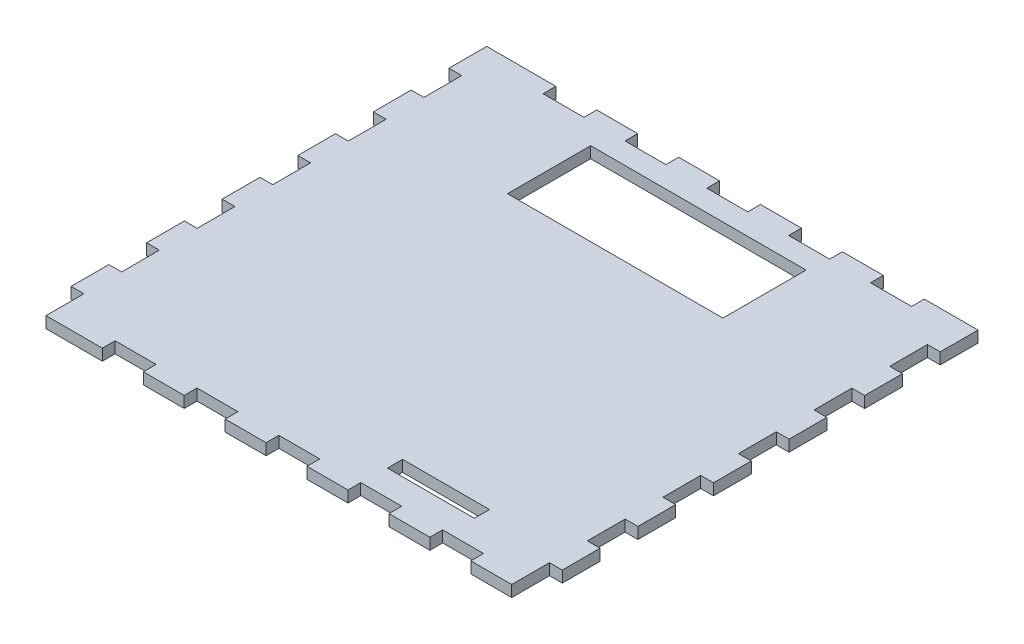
SolidWorks part; units mm, degrees
ref_plane "Front Plane" through (0, 0, 0) normal (0, 0, 1) x (1, 0, 0)
ref_plane "Top Plane" through (0, 0, 0) normal (0, 1, 0) x (1, 0, 0)
ref_plane "Right Plane" through (0, 0, 0) normal (1, 0, 0) x (0, 0, -1)
sketch "Sketch1" plane through (0, 0, 0) normal (0, 1, 0) x (1, 0, 0)
  line L0 (30, -49.7642) -> (30, -60) construction
  line L1 (-65, 60) -> (65, 60)
  line L2 (-65, 60) -> (-65, -60)
  line L3 (-65, -60) -> (65, -60)
  line L4 (65, 60) -> (65, -60)
  line L5 (-65, 60) -> (65, -60) construction
  line L6 (-65, -60) -> (65, 60) construction
  line L7 (65, -47.7642) -> (30, -47.7642) construction
  line L8 (18.5, -45.7642) -> (41.5, -45.7642)
  line L9 (18.5, -45.7642) -> (18.5, -49.7642)
  line L10 (18.5, -49.7642) -> (41.5, -49.7642)
  line L11 (41.5, -45.7642) -> (41.5, -49.7642)
  line L12 (18.5, -45.7642) -> (41.5, -49.7642) construction
  line L13 (18.5, -49.7642) -> (41.5, -45.7642) construction
  point P0 (0, 0)
  dimension "D1" = 120
  dimension "D2" = 130
  dimension "D3" = 23
  dimension "D4" = 35
  dimension "D5" = 4
  dimension "D6" = 10.2358
extrude "Boss-Extrude1" add sketch "Sketch1" along normal blind 3
sketch "Sketch3" plane through (0, 3, 0) normal (0, 1, 0) x (1, 0, 0)
  line L0 (0, 60) -> (0, 40) construction
  line L1 (65, 60) -> (-65, 60) construction
  line L3 (-28.5, 51) -> (28.5, 51)
  line L4 (-28.5, 51) -> (-28.5, 29)
  line L5 (-28.5, 29) -> (28.5, 29)
  line L6 (28.5, 51) -> (28.5, 29)
  line L7 (-28.5, 51) -> (28.5, 29) construction
  line L8 (-28.5, 29) -> (28.5, 51) construction
  dimension "D1" = 20
  dimension "D2" = 22
  dimension "D3" = 57
extrude "Cut-Extrude1" cut sketch "Sketch3" against normal blind 3
sketch "Sketch4" plane through (0, 3, 0) normal (0, 1, 0) x (1, 0, 0)
  line L0 (-65, 60) -> (-65, 50)
  line L1 (-65, 60) -> (-65, -60) construction
  line L2 (-65, 50) -> (-61.62, 50)
  line L3 (-61.62, 50) -> (-61.62, 40)
  line L4 (-61.62, 40) -> (-65, 40)
  line L5 (-65, 40) -> (-65, 30)
  line L6 (-65, 30) -> (-61.62, 30)
  line L7 (-61.62, 30) -> (-61.62, 20)
  line L8 (-61.62, 20) -> (-65, 20)
  line L9 (-65, 20) -> (-65, 10)
  line L10 (-65, 10) -> (-61.62, 10)
  line L11 (-61.62, 10) -> (-61.62, 0)
  line L12 (-61.62, 0) -> (-65, 0)
  line L13 (-65, 0) -> (-65, -10)
  line L14 (-65, -10) -> (-61.62, -10)
  line L15 (-61.62, -10) -> (-61.62, -20)
  line L16 (-61.62, -20) -> (-65, -20)
  line L17 (-65, -20) -> (-65, -30)
  line L18 (-65, -30) -> (-61.62, -30)
  line L19 (-61.62, -30) -> (-61.62, -40)
  line L20 (-61.62, -40) -> (-65, -40)
  line L21 (-65, -40) -> (-65, -50)
  line L22 (-65, -50) -> (-61.62, -50)
  line L23 (-61.62, -50) -> (-61.62, -60)
  line L24 (-65, -60) -> (65, -60) construction
  line L25 (0, 60) -> (0, -60) construction
  line L26 (65, 60) -> (-65, 60) construction
  line L27 (61.62, -50) -> (61.62, -60)
  line L28 (65, -50) -> (61.62, -50)
  line L29 (65, -40) -> (65, -50)
  line L30 (61.62, -40) -> (65, -40)
  line L31 (61.62, -30) -> (61.62, -40)
  line L32 (65, -30) -> (61.62, -30)
  line L33 (65, -20) -> (65, -30)
  line L34 (61.62, -20) -> (65, -20)
  line L35 (61.62, -10) -> (61.62, -20)
  line L36 (65, -10) -> (61.62, -10)
  line L37 (65, 0) -> (65, -10)
  line L38 (61.62, 0) -> (65, 0)
  line L39 (61.62, 10) -> (61.62, 0)
  line L40 (65, 10) -> (61.62, 10)
  line L41 (65, 20) -> (65, 10)
  line L42 (61.62, 20) -> (65, 20)
  line L43 (61.62, 30) -> (61.62, 20)
  line L44 (65, 30) -> (61.62, 30)
  line L45 (65, 40) -> (65, 30)
  line L46 (61.62, 40) -> (65, 40)
  line L47 (61.62, 50) -> (61.62, 40)
  line L48 (65, 50) -> (61.62, 50)
  line L49 (65, 60) -> (65, 50)
  line L50 (-65, 60) -> (-65, -60)
  line L51 (-65, -60) -> (-61.62, -60)
  line L52 (65, 60) -> (65, -60)
  line L53 (65, -60) -> (61.62, -60)
extrude "Cut-Extrude2" cut sketch "Sketch4" against normal blind 3 contours L44 L43 L42 M5 | L48 L47 L46 M5 | L40 L39 L38 M5 | L36 L35 L34 M5 | L28 L27 M5 M8 | L32 L31 L30 M5 | L23 L22 M7 M8 | L20 L19 L18 M7 | L16 L15 L14 M7 | L12 L11 L10 M7 | L8 L7 L6 M7 | L4 L3 L2 M7
sketch "Sketch5" plane through (0, 3, 0) normal (0, 1, 0) x (1, 0, 0)
  line L0 (61.62, 0) -> (-61.62, 0) construction
  line L2 (50.7867, 60) -> (61.62, 60)
  line L3 (-61.62, -60) -> (61.62, -60) construction
  line L4 (50.7867, 56.62) -> (50.7867, 60)
  line L5 (-46.7133, -60) -> (-46.7133, -56.62)
  line L6 (-46.7133, -56.62) -> (-35.88, -56.62)
  line L7 (-35.88, -56.62) -> (-35.88, -60)
  line L8 (-35.88, -60) -> (-25.0467, -60)
  line L9 (-25.0467, -60) -> (-25.0467, -56.62)
  line L10 (-25.0467, -56.62) -> (-14.2133, -56.62)
  line L11 (-14.2133, -56.62) -> (-14.2133, -60)
  line L12 (-14.2133, -60) -> (-3.38, -60)
  line L13 (-3.38, -60) -> (-3.38, -56.62)
  line L14 (-3.38, -56.62) -> (7.4533, -56.62)
  line L15 (7.4533, -56.62) -> (7.4533, -60)
  line L16 (7.4533, -60) -> (18.2867, -60)
  line L17 (18.2867, -60) -> (18.2867, -56.62)
  line L18 (18.2867, -56.62) -> (29.12, -56.62)
  line L19 (29.12, -56.62) -> (29.12, -60)
  line L20 (29.12, -60) -> (39.9533, -60)
  line L21 (39.9533, -60) -> (39.9533, -56.62)
  line L22 (39.9533, -56.62) -> (50.7867, -56.62)
  line L23 (50.7867, -56.62) -> (50.7867, -60)
  line L24 (50.7867, -60) -> (61.62, -60)
  line L25 (39.9533, 56.62) -> (50.7867, 56.62)
  line L26 (39.9533, 60) -> (39.9533, 56.62)
  line L27 (29.12, 60) -> (39.9533, 60)
  line L28 (29.12, 56.62) -> (29.12, 60)
  line L29 (18.2867, 56.62) -> (29.12, 56.62)
  line L30 (18.2867, 60) -> (18.2867, 56.62)
  line L31 (7.4533, 60) -> (18.2867, 60)
  line L32 (7.4533, 56.62) -> (7.4533, 60)
  line L33 (-3.38, 56.62) -> (7.4533, 56.62)
  line L34 (-3.38, 60) -> (-3.38, 56.62)
  line L35 (-14.2133, 60) -> (-3.38, 60)
  line L36 (-14.2133, 56.62) -> (-14.2133, 60)
  line L37 (-25.0467, 56.62) -> (-14.2133, 56.62)
  line L38 (-25.0467, 60) -> (-25.0467, 56.62)
  line L39 (-35.88, 60) -> (-25.0467, 60)
  line L40 (-35.88, 56.62) -> (-35.88, 60)
  line L41 (-46.7133, 56.62) -> (-35.88, 56.62)
  line L42 (-46.7133, 60) -> (-46.7133, 56.62)
  line L43 (-46.7133, -60) -> (50.7867, -60)
  line L44 (-46.7133, 60) -> (50.7867, 60)
extrude "Cut-Extrude3" cut sketch "Sketch5" against normal blind 3 contours L44 L42 L41 L40 | L44 L38 L37 L36 | L44 L34 L33 L32 | L44 L30 L29 L28 | L44 L26 L25 L4 | L21 L43 L23 L22 | L17 L43 L19 L18 | L13 L43 L15 L14 | L9 L43 L11 L10 | L5 L43 L7 L6
equation "\"length\"= 120mm"
equation "\"D1@Sketch4\"=\"length\"/12"
equation "\"D2@Sketch4\"=\"length\"/12"
equation "\"D3@Sketch4\"=\"length\"/12"
equation "\"D4@Sketch4\"=\"length\"/12"
equation "\"D5@Sketch4\"=\"length\"/12"
equation "\"D6@Sketch4\"=\"length\"/12"
equation "\"D7@Sketch4\"=\"length\"/12"
equation "\"D8@Sketch4\"=\"length\"/12"
equation "\"D9@Sketch4\"=\"length\"/12"
equation "\"D10@Sketch4\"=\"length\"/12"
equation "\"D11@Sketch4\"=\"length\"/12"
equation "\"thickness of material\"= 3.38mm"
equation "\"D12@Sketch4\"=\"thickness of material\""
equation "\"D13@Sketch4\"=\"thickness of material\""
equation "\"D14@Sketch4\"=\"thickness of material\""
equation "\"D15@Sketch4\"=\"thickness of material\""
equation "\"D16@Sketch4\"=\"thickness of material\""
equation "\"D17@Sketch4\"=\"thickness of material\""
equation "\"width\"= 130mm"
equation "\"D1@Sketch5\"=\"width\"/12"
equation "\"D2@Sketch5\"=\"width\"/12"
equation "\"D3@Sketch5\"=\"width\"/12"
equation "\"D4@Sketch5\"=\"width\"/12"
equation "\"D5@Sketch5\"=\"width\"/12"
equation "\"D6@Sketch5\"=\"width\"/12"
equation "\"D7@Sketch5\"=\"width\"/12"
equation "\"D8@Sketch5\"=\"width\"/12"
equation "\"D9@Sketch5\"=\"width\"/12"
equation "\"D10@Sketch5\"=\"width\"/12"
equation "\"D11@Sketch5\"=\"thickness of material\""
equation "\"D12@Sketch5\"=\"thickness of material\""
equation "\"D13@Sketch5\"=\"thickness of material\""
equation "\"D14@Sketch5\"=\"thickness of material\""
equation "\"D15@Sketch5\"=\"thickness of material\""
